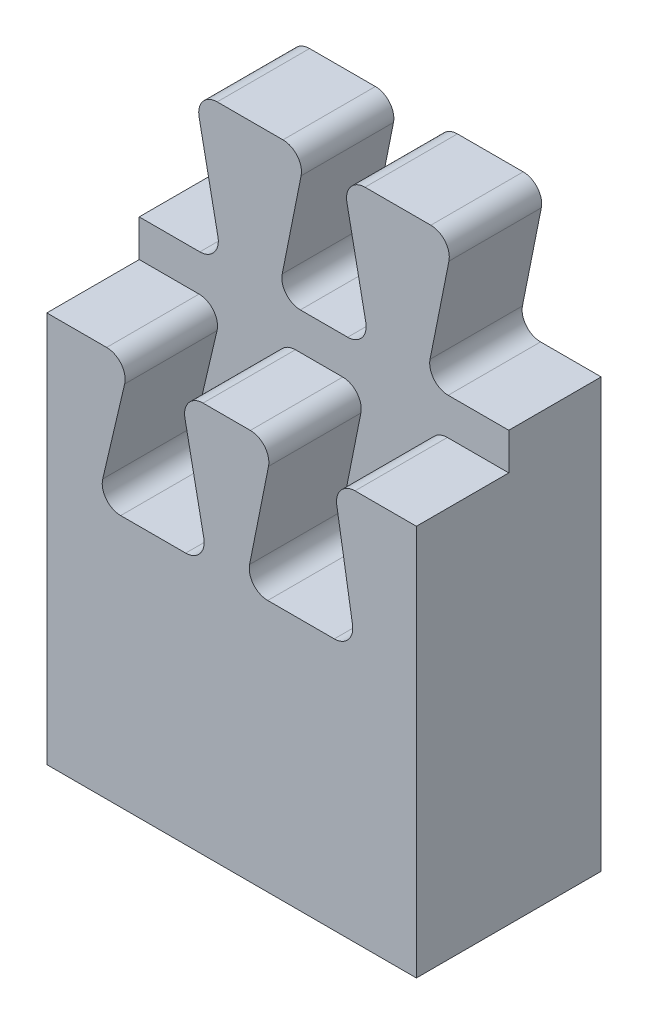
SolidWorks part; units mm, degrees
ref_plane "Ebene vorne" through (0, 0, 0) normal (0, 0, 1) x (1, 0, 0)
ref_plane "Ebene oben" through (0, 0, 0) normal (0, 1, 0) x (1, 0, 0)
ref_plane "Ebene rechts" through (0, 0, 0) normal (1, 0, 0) x (0, 0, -1)
sketch "Skizze1" plane through (0, 0, 0) normal (0, 0, 1) x (1, 0, 0)
  line L0 (-1.7339, 36.6112) -> (2.7661, 36.6112)
  line L3 (2.7661, 36.6112) -> (1.2661, 44.1112)
  line L4 (1.2661, 44.1112) -> (7.2661, 44.1112)
  line L5 (7.2661, 44.1112) -> (5.7661, 36.6112)
  line L6 (5.7661, 36.6112) -> (10.7661, 36.6112)
  line L7 (10.7661, 36.6112) -> (9.2661, 44.1112)
  line L8 (9.2661, 44.1112) -> (15.2661, 44.1112)
  line L9 (15.2661, 44.1112) -> (13.7661, 36.6112)
  line L10 (13.7661, 36.6112) -> (18.2661, 36.6112)
  line L11 (-1.7339, 36.6112) -> (-1.7339, 13.4395)
  line L12 (-1.7339, 13.4395) -> (18.2661, 13.4395)
  line L13 (18.2661, 13.4395) -> (18.2661, 36.6112)
  point P1 (-1.7339, 36.6112)
  point P3 (1.2661, 44.1112)
  point P6 (2.7661, 36.6112)
  point P7 (5.7661, 36.6112)
  point P8 (7.2661, 44.1112)
  point P9 (10.7661, 36.6112)
  point P10 (9.2661, 44.1112)
  point P11 (15.2661, 44.1112)
  point P12 (13.7661, 36.6112)
  point P15 (18.2661, 36.6112)
  dimension "D1" = 20
  dimension "D2" = 1.5
  dimension "D3" = 5
  dimension "D4" = 1.5
  dimension "D5" = 7.5
  dimension "D6" = 7.5
  dimension "D7" = 7.5
  dimension "D8" = 0
  dimension "D9" = 6
  dimension "D10" = 6
  dimension "D11" = 3
  dimension "D12" = 4.5
  dimension "D13" = 1.5
  dimension "D14" = 4.5
extrude "Aufsatz-Linear austragen2" add sketch "Skizze1" along normal blind 5 contours L4 L5 L6 L7 L8 L9 L10 L13 L12 L11 L0 L3
sketch "Skizze4" plane through (0, 0, 5) normal (0, 0, 1) x (1, 0, 0)
  line L0 (-1.7339, 36.6112) -> (-1.7339, 13.4395) construction
  line L1 (-1.7339, 34.6112) -> (2.7661, 34.6112)
  line L2 (2.7661, 34.6112) -> (1.0009, 27.1112)
  line L3 (1.0009, 27.1112) -> (7.0009, 27.1112)
  line L4 (7.0009, 27.1112) -> (5.5009, 34.6112)
  line L5 (5.5009, 34.6112) -> (10.5009, 34.6112)
  line L6 (10.5009, 34.6112) -> (9.0009, 27.1112)
  line L7 (9.0009, 27.1112) -> (15.0009, 27.1112)
  line L8 (15.0009, 27.1112) -> (13.7661, 34.6112)
  line L9 (13.7661, 34.6112) -> (18.2661, 34.6112)
  line L10 (18.2661, 13.4395) -> (18.2661, 36.6112) construction
  line L11 (-1.7339, 36.6112) -> (2.7661, 36.6112) construction
  line L12 (13.7661, 36.6112) -> (18.2661, 36.6112) construction
  line L13 (-1.7339, 34.6112) -> (-1.7339, 13.4395)
  line L14 (-1.7339, 13.4395) -> (18.2661, 13.4395)
  line L15 (18.2661, 13.4395) -> (18.2661, 34.6112)
  point P0 (-1.7339, 34.6112)
  point P1 (2.7661, 34.6112)
  point P4 (1.0009, 27.1112)
  point P5 (7.0009, 27.1112)
  point P6 (5.5009, 34.6112)
  point P7 (10.5009, 34.6112)
  point P8 (13.7661, 34.6112)
  point P9 (9.0009, 27.1112)
  point P10 (15.0009, 27.1112)
  dimension "D1" = 4.5
  dimension "D2" = 6
  dimension "D3" = 6
  dimension "D4" = 5
  dimension "D5" = 1.5
  dimension "D6" = 1.5
  dimension "D7" = 4.5
  dimension "D8" = 2
  dimension "D9" = 2
  dimension "D10" = 7.5
  dimension "D11" = 7.5
  dimension "D12" = 7.5
extrude "Aufsatz-Linear austragen3" add sketch "Skizze4" along normal blind 5 contours L3 L4 L5 L6 L7 L8 L9 L15 L14 L13 L1 L2
fillet "Verrundung1" radius 1 16 edges at (1.0009, 27.1112, 7.5) (5.5009, 34.6112, 7.5) (2.7661, 34.6112, 7.5) (2.7661, 36.6112, 2.5) (10.7661, 36.6112, 2.5) (15.0009, 27.1112, 7.5) (7.0009, 27.1112, 7.5) (9.0009, 27.1112, 7.5) (10.5009, 34.6112, 7.5) (13.7661, 34.6112, 7.5) (13.7661, 36.6112, 2.5) (15.2661, 44.1112, 2.5) (9.2661, 44.1112, 2.5) (1.2661, 44.1112, 2.5) (7.2661, 44.1112, 2.5) (5.7661, 36.6112, 2.5)
